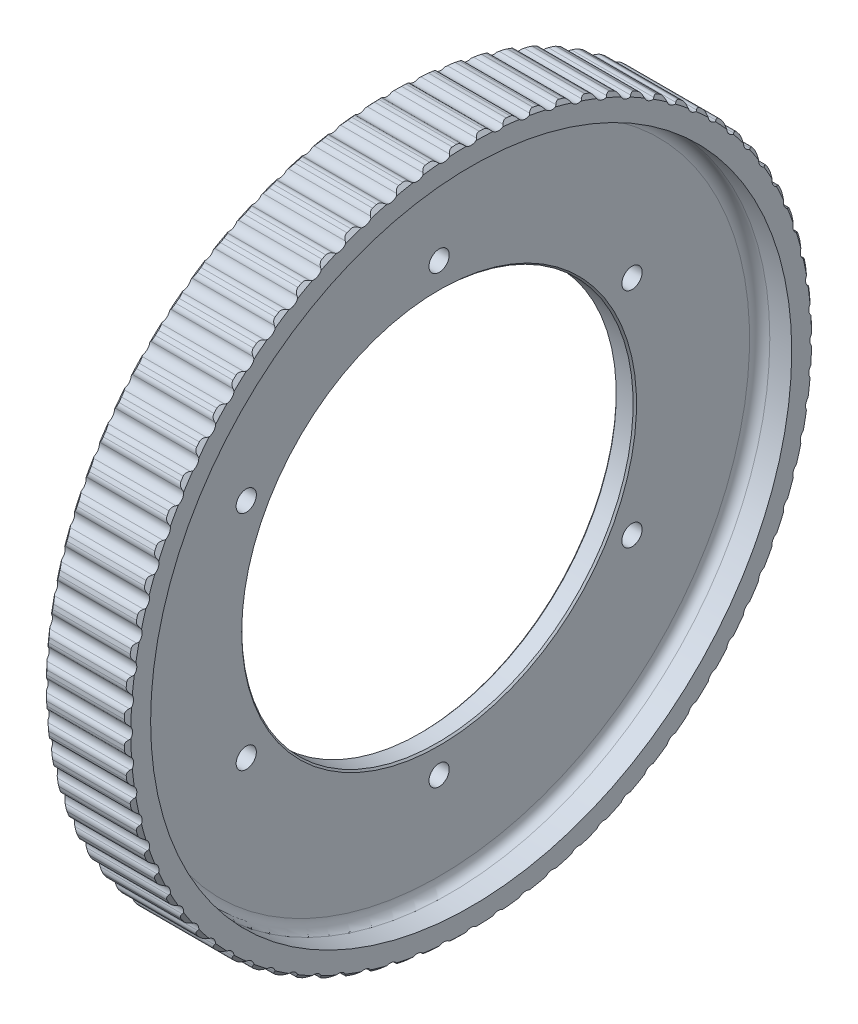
SolidWorks part; units mm, degrees
ref_plane "Plan1" through (0, 0, 0) normal (0, 0, 1) x (1, 0, 0)
ref_plane "Plan2" through (0, 0, 0) normal (0, 1, 0) x (1, 0, 0)
ref_plane "Plan3" through (0, 0, 0) normal (1, 0, 0) x (0, 0, -1)
sketch "Esquisse1" plane through (0, 0, 0) normal (0, 0, 1) x (1, 0, 0)
  line L0 (-82.3, 0) -> (88.4, 0) construction
  line L1 (-43, 101.86) -> (-18, 101.86)
  line L2 (-18, 101.86) -> (-18, 95)
  line L3 (-18, 95) -> (-24.5, 95)
  line L4 (-27.5, 92) -> (-27.5, 58.5)
  line L5 (-33.5, 58.5) -> (-33, 58)
  line L6 (-27.5, 58.5) -> (-28, 58)
  line L7 (-28, 58) -> (-33, 58)
  line L10 (-33.5, 58.5) -> (-33.5, 92)
  line L11 (-36.5, 95) -> (-43, 95)
  line L12 (-43, 95) -> (-43, 101.86)
  arc A2 (-27.5, 92) -> (-24.5, 95) centre (-24.5, 92) cw
  arc A3 (-36.5, 95) -> (-33.5, 92) centre (-36.5, 92) cw
  point P23 (-33.5, 95)
  dimension "D9" = 9.5
  dimension "D8" = 3
  dimension "D1" = 58
  dimension "D2" = 0.5
  dimension "D3" = 101.86
  dimension "D4" = 95
  dimension "D5" = 6
  dimension "D6" = 0.5
  dimension "D7" = 25
revolve "Base-Révolution" add sketch "Esquisse1" angle 360 about L0
chamfer "Chanfrein6" distance 1 angle 45
sketch "Esquisse3" plane through (-18, 0, 0) normal (1, 0, 0) x (0, 0, -1)
  line L0 (0, 111.8) -> (0, 0) construction
  arc A1 (-1.8358, 101.163) -> (1.8358, 101.163) centre (0, 102.86) ccw
  circle A3 centre (0, 0) radius 101.86 construction
  arc A4 (-3.3706, 101.8042) -> (-8.7546, 101.4831) centre (0, 0) ccw
  arc A5 (3.3706, 101.8042) -> (1.8358, 101.163) centre (3.3044, 99.8053) ccw
  arc A6 (-1.8358, 101.163) -> (-3.3706, 101.8042) centre (-3.3044, 99.8053) ccw
  arc A7 (8.7546, 101.4831) -> (-8.7546, 101.4831) centre (0, 109) ccw
  arc A8 (8.7546, 101.4831) -> (3.3706, 101.8042) centre (0, 0) ccw
  dimension "D1" = 5
  dimension "D3" = 2
  dimension "D2" = 102.86
extrude "Enlèv. mat.-Extru.1" cut sketch "Esquisse3" against normal through all
pattern_circular "Répétition circulaire1" count 80 every 4.5 about axis through (-82.3, 0, 0) along (1, 0, 0)
sketch "Esquisse4" plane through (-27.5, 0, 0) normal (1, 0, 0) x (0, 0, -1)
  line L2 (0, 0) -> (0, 66) construction
  circle A0 centre (0, 66) radius 3
  circle A1 centre (57.1577, 33) radius 3
  circle A2 centre (57.1577, -33) radius 3
  circle A3 centre (0, -66) radius 3
  circle A4 centre (-57.1577, -33) radius 3
  circle A5 centre (-57.1577, 33) radius 3
  dimension "D1" = 6
  dimension "D4" = 66
extrude "Enlèv. mat.-Extru.2" cut sketch "Esquisse4" against normal blind 10
equation "\"D2@Esquisse3\" = \"D3@Esquisse1\" +1"
